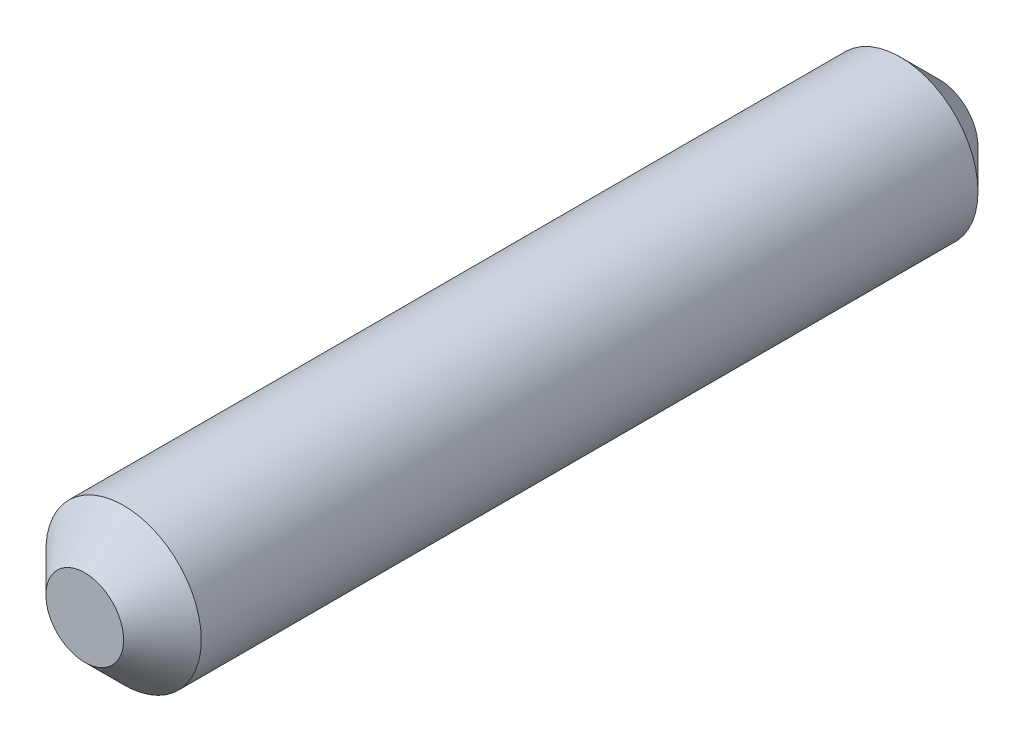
SolidWorks part; units mm, degrees
ref_plane "Front Plane" through (0, 0, 0) normal (0, 0, 1) x (1, 0, 0)
ref_plane "Top Plane" through (0, 0, 0) normal (0, 1, 0) x (1, 0, 0)
ref_plane "Right Plane" through (0, 0, 0) normal (1, 0, 0) x (0, 0, -1)
sketch "Sketch1" plane through (0, 0, 0) normal (0, 0, 1) x (1, 0, 0)
  circle A0 centre (0, 0) radius 1
  dimension "D1" = 2
extrude "Boss-Extrude1" add sketch "Sketch1" along normal blind 11
chamfer "Chamfer1" distance 0.5 angle 45 2 edges at (1, 0, 0) (1, 0, 11)
